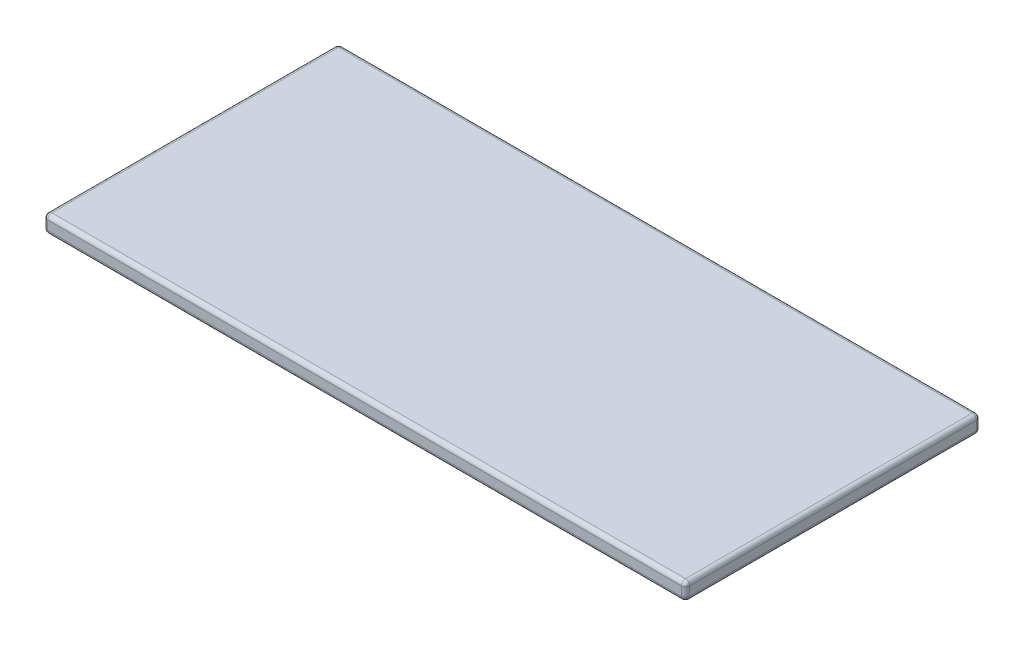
SolidWorks part; units mm, degrees
ref_plane "Face" through (0, 0, 0) normal (0, 0, 1) x (1, 0, 0)
ref_plane "Dessus" through (0, 0, 0) normal (0, 1, 0) x (1, 0, 0)
ref_plane "Droite" through (0, 0, 0) normal (1, 0, 0) x (0, 0, -1)
sketch "Esquisse1" plane through (0, 0, 0) normal (0, 1, 0) x (1, 0, 0)
  line L0 (925, 425) -> (-925, -425) construction
  line L1 (-925, 425) -> (925, 425)
  line L2 (-925, 425) -> (-925, -425)
  line L3 (-925, -425) -> (925, -425)
  line L4 (925, 425) -> (925, -425)
  dimension "D1" = 850
  dimension "D2" = 1850
extrude "Extrusion1" add sketch "Esquisse1" against normal blind 50
fillet "Congé1" radius 12 12 edges at (-925, -25, -425) (-925, -50, 0) (0, -50, -425) (-925, 0, 0) (0, 0, 425) (925, 0, 0) (0, 0, -425) (0, -50, 425) (925, -50, 0) (-925, -25, 425) (925, -25, 425) (925, -25, -425)
